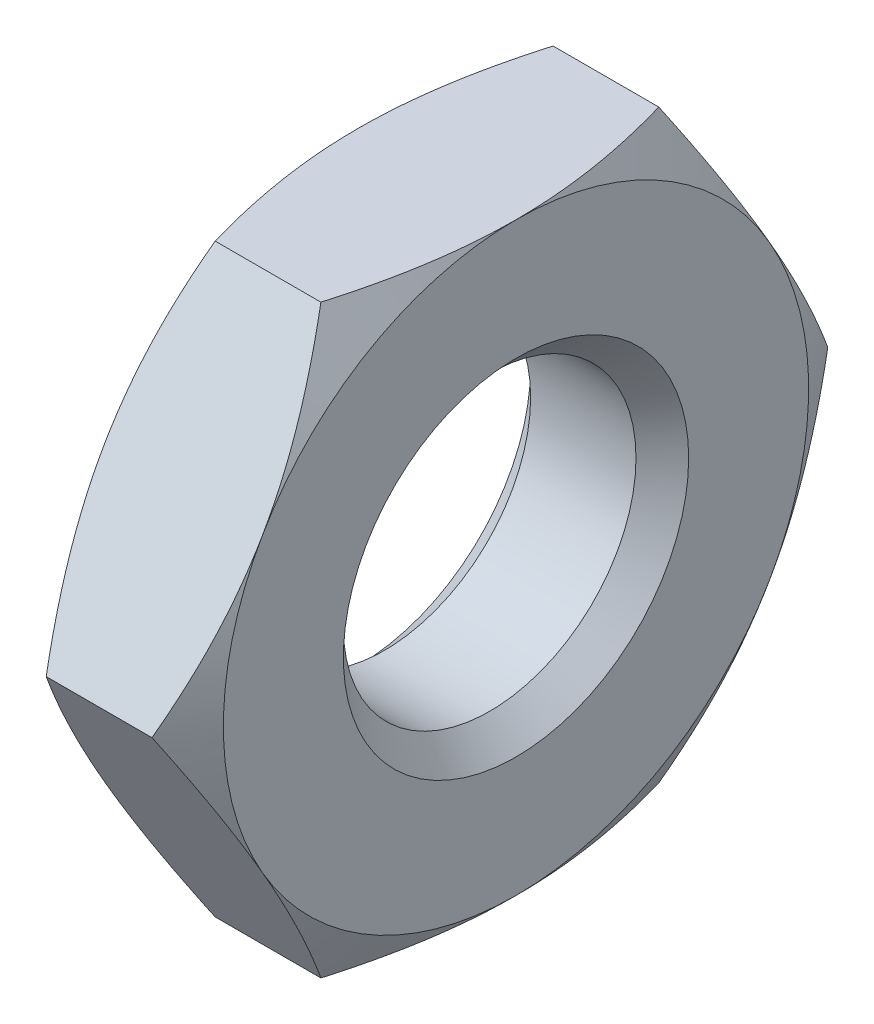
SolidWorks part; units mm, degrees
ref_plane "Front Plane" through (0, 0, 0) normal (0, 0, 1) x (1, 0, 0)
ref_plane "Top Plane" through (0, 0, 0) normal (0, 1, 0) x (1, 0, 0)
ref_plane "Right Plane" through (0, 0, 0) normal (1, 0, 0) x (0, 0, -1)
sketch "Sketch1" plane through (0, 0, 0) normal (1, 0, 0) x (0, 0, -1)
  line L1 (1.4434, 2.5) -> (-1.4434, 2.5)
  line L2 (-1.4434, 2.5) -> (-2.8868, 0)
  line L3 (-2.8868, 0) -> (-1.4434, -2.5)
  line L4 (-1.4434, -2.5) -> (1.4434, -2.5)
  line L5 (1.4434, -2.5) -> (2.8868, 0)
  line L6 (2.8868, 0) -> (1.4434, 2.5)
  circle A0 centre (0, 0) radius 2.5 construction
  circle A1 centre (0, 0) radius 1.25
extrude "Extrude1" add sketch "Sketch1" along normal blind 1.35
sketch "Sketch2" plane through (0, 0, 0) normal (0, 0, 1) x (1, 0, 0)
  line L0 (1.35, 2.5) -> (1.35, 10)
  line L1 (1.35, 10) -> (0, 10)
  line L2 (0, 10) -> (0, 2.5)
  line L3 (0, 2.5) -> (0.675, 3.6691)
  line L4 (0.675, 3.6691) -> (1.35, 2.5)
revolve "Cut-Revolve1" cut sketch "Sketch2" angle 360 about axis through (1.35, 0, 0) along (-1, 0, 0)
chamfer "Chamfer1" distance 0.225 angle 45 2 edges at (0, 0, -1.25) (1.35, 0, -1.25)
equation "\"D2@Sketch2\"=\"D1@Sketch1\"*2"
